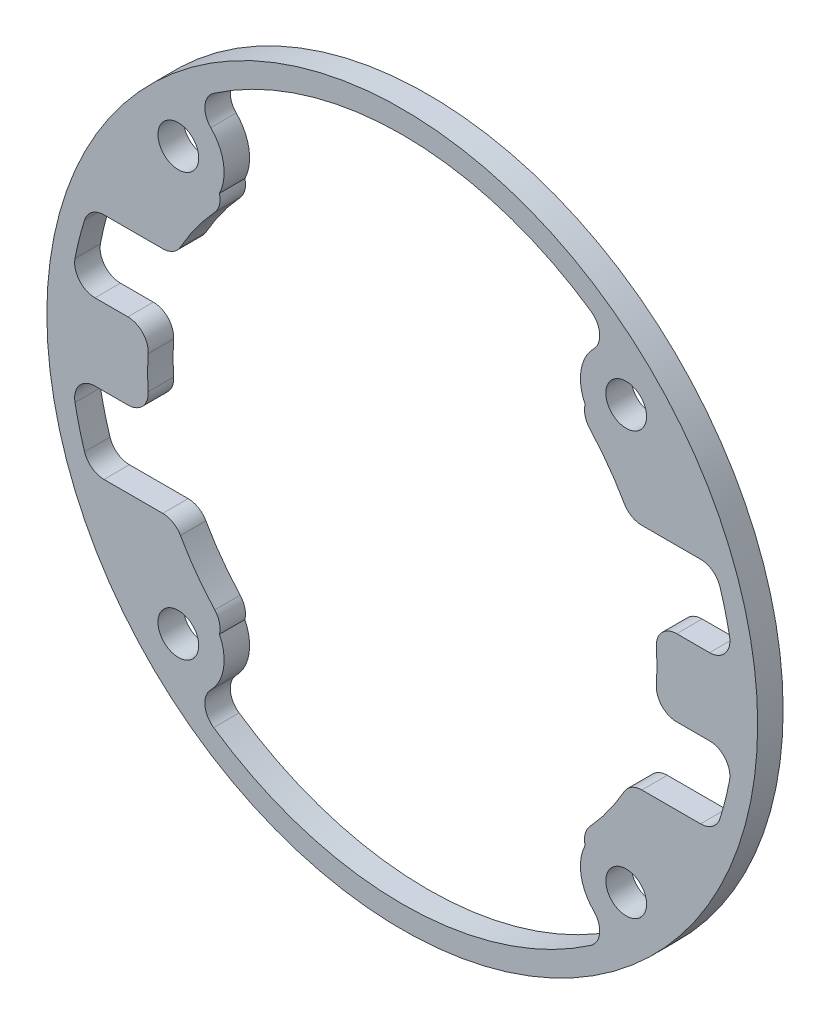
SolidWorks part; units mm, degrees
ref_plane "Front Plane" through (0, 0, 0) normal (0, 0, 1) x (1, 0, 0)
ref_plane "Top Plane" through (0, 0, 0) normal (0, 1, 0) x (1, 0, 0)
ref_plane "Right Plane" through (0, 0, 0) normal (1, 0, 0) x (0, 0, -1)
sketch "Sketch1" plane through (0, 0, 0) normal (0, 0, 1) x (1, 0, 0)
  line L0 (-16.0872, 0) -> (0, 0) construction
  line L5 (0, 20.0235) -> (0, -16.7772) construction
  line L6 (-18.2111, 9.525) -> (31.3181, 9.525) construction
  line L11 (-20.6375, 2.3813) -> (20.6375, 2.3812)
  line L12 (-19.5075, 7.1438) -> (19.5075, 7.1438)
  line L13 (-11.4006, 11.9062) -> (11.4006, 11.9062)
  line L14 (-11.4006, -11.9062) -> (11.4006, -11.9062)
  line L15 (-19.5075, -7.1438) -> (19.5075, -7.1438)
  line L16 (-20.6375, -2.3813) -> (20.6375, -2.3812)
  circle A0 centre (0, 0) radius 22.1615
  arc A1 (-20.6375, 2.3813) -> (-19.5075, 7.1438) centre (0, 0) cw
  arc A2 (20.6375, 2.3812) -> (19.5075, 7.1438) centre (0, 0) ccw
  arc A3 (-13.3147, 15.9466) -> (13.3147, 15.9466) centre (0, 0) cw
  arc A4 (13.3147, -15.9466) -> (11.4006, -11.9062) centre (13.9623, -13.1662) cw
  arc A5 (20.6375, -2.3812) -> (19.5075, -7.1438) centre (0, 0) cw
  arc A6 (-20.6375, -2.3813) -> (-19.5075, -7.1438) centre (0, 0) ccw
  circle A7 centre (-13.9623, 13.1662) radius 1.27
  arc A8 (-13.3147, 15.9466) -> (-11.4006, 11.9062) centre (-13.9623, 13.1662) cw
  circle A9 centre (13.9623, 13.1662) radius 1.27
  arc A10 (13.3147, 15.9466) -> (11.4006, 11.9062) centre (13.9623, 13.1662) ccw
  circle A11 centre (13.9623, -13.1662) radius 1.27
  arc A12 (-13.3147, -15.9466) -> (-11.4006, -11.9062) centre (-13.9623, -13.1662) ccw
  circle A13 centre (-13.9623, -13.1662) radius 1.27
  arc A14 (-13.3147, -15.9466) -> (13.3147, -15.9466) centre (0, 0) ccw
  dimension "D8" = 44.323
  dimension "D7" = 9.525
  dimension "D12" = 20.6375
  dimension "D13" = 41.275
extrude "Extrude1" add sketch "Sketch1" along normal blind 1.5875
sketch "Sketch2" plane through (0, 0, 1.5875) normal (0, 0, 1) x (1, 0, 0)
  circle A0 centre (0, 0) radius 15.875
  dimension "D1" = 31.75
extrude "Cut-Extrude1" cut sketch "Sketch2" against normal blind 6.35
fillet "Fillet1" radius 1.27 24 edges at (13.3147, 15.9466, 0.7937) (10.5003, 11.9062, 0.7937) (-10.5003, 11.9062, 0.7937) (-14.1768, 7.1438, 0.7937) (14.1768, 7.1438, 0.7937) (20.6375, 2.3813, 0.7937) (19.5075, 7.1438, 0.7937) (15.6954, 2.3812, 0.7937) (-15.6954, 2.3813, 0.7937) (20.6375, -2.3812, 0.7937) (-15.6954, -2.3813, 0.7937) (15.6954, -2.3812, 0.7937) (19.5075, -7.1438, 0.7937) (14.1768, -7.1438, 0.7937) (-14.1768, -7.1438, 0.7937) (-10.5003, -11.9062, 0.7937) (10.5003, -11.9062, 0.7937) (13.3147, -15.9466, 0.7937) (-13.3147, -15.9466, 0.7937) (-19.5075, -7.1437, 0.7937) (-20.6375, -2.3813, 0.7937) (-20.6375, 2.3813, 0.7937) (-19.5075, 7.1438, 0.7937) (-13.3147, 15.9466, 0.7937)
